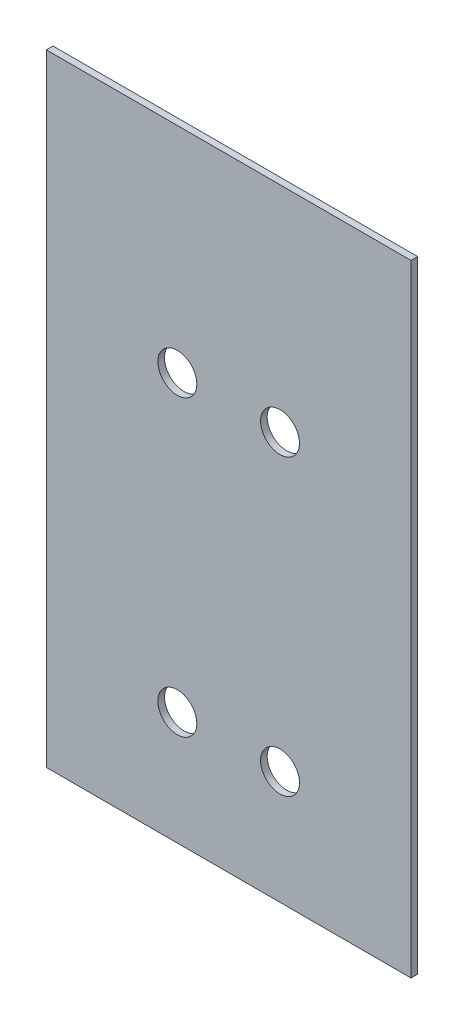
SolidWorks part; units mm, degrees
ref_plane "Front Plane" through (0, 0, 0) normal (0, 0, 1) x (1, 0, 0)
ref_plane "Top Plane" through (0, 0, 0) normal (0, 1, 0) x (1, 0, 0)
ref_plane "Right Plane" through (0, 0, 0) normal (1, 0, 0) x (0, 0, -1)
sketch "Sketch1" plane through (0, 0, 0) normal (0, 0, 1) x (1, 0, 0)
  line L1 (-234.95, -557.2125) -> (234.95, -557.2125)
  line L2 (-234.95, -557.2125) -> (-234.95, 557.2125)
  line L3 (-234.95, 557.2125) -> (234.95, 557.2125)
  line L4 (234.95, -557.2125) -> (234.95, 557.2125)
  line L5 (-234.95, -557.2125) -> (234.95, 557.2125) construction
  line L6 (-234.95, 557.2125) -> (234.95, -557.2125) construction
  point P0 (0, 0)
  dimension "D1" = 1114.425
  dimension "D2" = 469.9
extrude "Boss-Extrude1" add sketch "Sketch1" along normal blind 11.9062
sketch "Sketch2" plane through (0, 0, 11.9062) normal (0, 0, 1) x (1, 0, 0)
  line L1 (-234.95, -557.2125) -> (234.95, -557.2125) construction
  point P0 (0, 173.0375)
  point P1 (0, -354.0125)
  dimension "D1" = 527.05
  dimension "D2" = 203.2
hole_wizard "2 Clearance Hole1" positions "Sketch3" profile "Sketch4" hole size "2" standard "ANSI Inch"
sketch "Sketch3" plane through (0, 0, 11.9062) normal (0, 0, 1) x (1, 0, 0)
  point P0 (0, 173.0375)
  point P3 (0, -354.0125)
sketch "Sketch4" plane through (0, 173.0375, 11.9062) normal (1, 0, 0) x (0, -1, 0)
  line L0 (0, 0) -> (0, 11.9062)
  line L1 (0, 11.9062) -> (34.925, 11.9062)
  line L2 (34.925, 11.9062) -> (34.925, 0)
  line L5 (34.925, 0) -> (0, 0)
  line L11 (0, -6.35) -> (0, 107.95) construction
  dimension "Thru Hole Dia." = 69.85
  dimension "Thru Hole Depth" = 11.9062
sketch "Sketch5" plane through (0, 0, 11.9062) normal (0, 0, 1) x (1, 0, 0)
  line L1 (234.95, 557.2125) -> (419.1, 557.2125)
  line L2 (234.95, 557.2125) -> (234.95, -557.2125)
  line L3 (234.95, -557.2125) -> (419.1, -557.2125)
  line L4 (419.1, 557.2125) -> (419.1, -557.2125)
  line L5 (234.95, 557.2125) -> (419.1, -557.2125) construction
  line L6 (234.95, -557.2125) -> (419.1, 557.2125) construction
  line L7 (-234.95, -557.2125) -> (234.95, -557.2125) construction
  line L8 (-234.95, -557.2125) -> (234.95, -557.2125)
  point P4 (327.025, 0)
  dimension "D1" = 184.15
extrude "Boss-Extrude2" add sketch "Sketch5" against normal blind 11.9062 contours L4 L1 L3 M7
sketch "Sketch6" plane through (0, 0, 11.9062) normal (0, 0, 1) x (1, 0, 0)
  line L0 (419.1, 557.2125) -> (419.1, -557.2125) construction
  circle A0 centre (0, 173.0375) radius 34.925 construction
  circle A1 centre (0, 173.0375) radius 34.925
  circle A2 centre (0, -354.0125) radius 34.925 construction
  circle A3 centre (0, -354.0125) radius 34.925
  point P3 (184.15, 173.0375)
  point P7 (184.15, -354.0125)
  point P10 (0, 0)
  point P11 (0, 0)
  point P12 (0, 0)
  dimension "D1" = 234.95
hole_wizard "9/32 (2.75) Diameter Hole1" positions "Sketch7" profile "Sketch8" hole size "9/32" standard "ANSI Inch"
sketch "Sketch7" plane through (0, 0, 11.9062) normal (0, 0, 1) x (1, 0, 0)
  point P0 (184.15, 173.0375)
  point P3 (184.15, -354.0125)
sketch "Sketch8" plane through (184.15, 173.0375, 11.9062) normal (1, 0, 0) x (0, -1, 0)
  line L0 (0, 0) -> (0, 11.9062)
  line L1 (0, 11.9062) -> (34.925, 11.9062)
  line L2 (34.925, 11.9062) -> (34.925, 0)
  line L5 (34.925, 0) -> (0, 0)
  line L11 (0, -6.35) -> (0, 107.95) construction
  dimension "Thru Hole Dia." = 69.85
  dimension "Thru Hole Depth" = 11.9062
